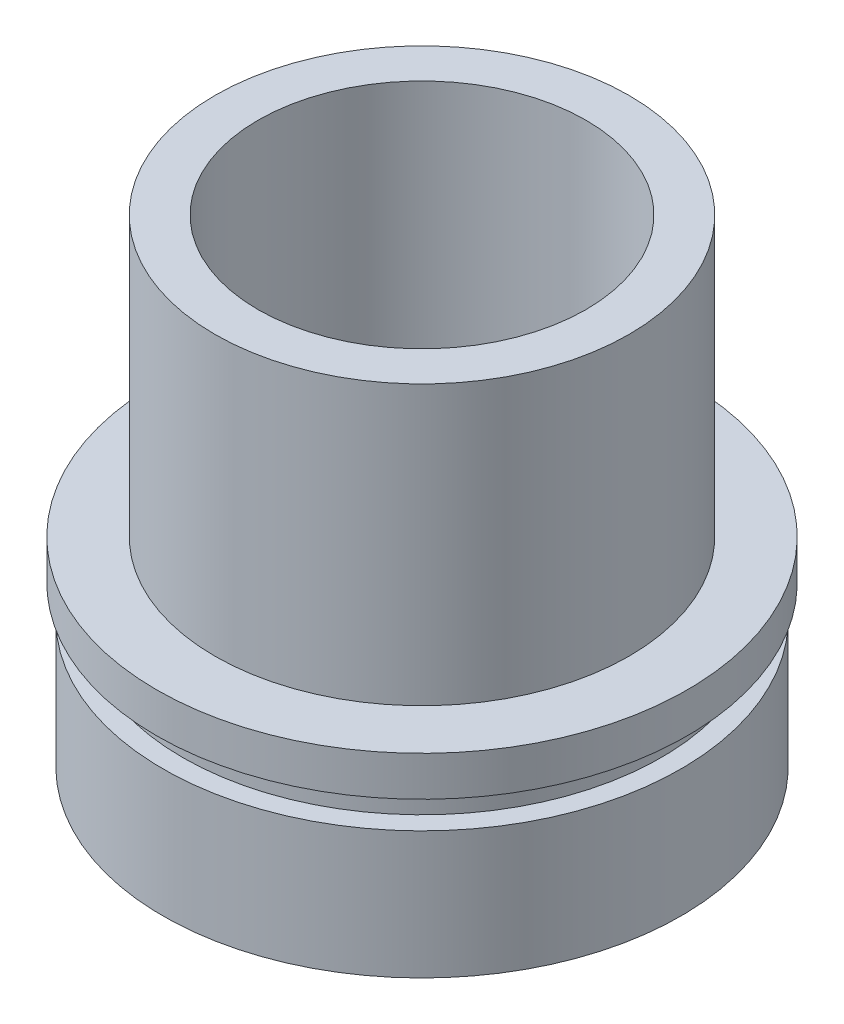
SolidWorks part; units mm, degrees
ref_plane "Front Plane" through (0, 0, 0) normal (0, 0, 1) x (1, 0, 0)
ref_plane "Top Plane" through (0, 0, 0) normal (0, 1, 0) x (1, 0, 0)
ref_plane "Right Plane" through (0, 0, 0) normal (1, 0, 0) x (0, 0, -1)
sketch "Sketch1" plane through (0, 0, 0) normal (0, 0, 1) x (1, 0, 0)
  line L0 (0, 0) -> (0, 61.1946) construction
  line L1 (-6.5405, 0) -> (-10.3251, 0)
  line L2 (-10.3251, 0) -> (-10.3251, 6.35)
  line L3 (-10.3251, 6.35) -> (-10.5791, 6.35)
  line L4 (-10.5791, 6.35) -> (-10.5791, 7.9375)
  line L5 (-10.5791, 7.9375) -> (-8.255, 7.9375)
  line L6 (-6.5405, 0) -> (-6.5405, 19.05)
  line L8 (-6.5405, 19.05) -> (-8.255, 19.05)
  line L12 (-8.255, 19.05) -> (-8.255, 7.9375)
  dimension "D1" = 20.6502
  dimension "D2" = 13.081
  dimension "D3" = 6.35
  dimension "D4" = 19.05
  dimension "D5" = 0.254
  dimension "D6" = 16.51
  dimension "D7" = 1.5875
revolve "Revolve1" add sketch "Sketch1" angle 360 about L0
sketch "Sketch3" plane through (0, 0, 0) normal (0, 0, 1) x (1, 0, 0)
  line L0 (0, 0) -> (0, -6.2728) construction
  line L1 (-6.5405, 7.9375) -> (-6.5405, 19.05)
  line L2 (-6.5405, 19.05) -> (-6.5405, 0) construction
  line L3 (10.5791, 7.9375) -> (-10.5791, 7.9375) construction
  line L4 (-6.5405, 19.05) -> (-4.9022, 19.05)
  line L5 (8.255, 19.05) -> (-8.255, 19.05) construction
  line L6 (-4.9022, 19.05) -> (-4.9022, 6.2992)
  line L7 (-4.9022, 6.2992) -> (-6.5405, 7.9375)
  dimension "D1" = 45
  dimension "D2" = 9.8044
revolve "Cut-Revolve2" [suppressed] cut sketch "Sketch3" angle 360 about L0
sketch "Sketch4" plane through (0, 0, 0) normal (0, 0, 1) x (1, 0, 0)
  line L0 (-10.3251, 6.35) -> (10.3251, 6.35) construction
  line L1 (-11.4466, 6.35) -> (-9.5402, 6.35)
  line L2 (-11.4466, 6.35) -> (-11.4466, 5.08)
  line L3 (-11.4466, 5.08) -> (-9.5402, 5.08)
  line L4 (-9.5402, 6.35) -> (-9.5402, 5.08)
  line L5 (-10.5791, 6.35) -> (10.5791, 6.35) construction
  line L6 (0, 0) -> (0, -3.7143) construction
  dimension "D1" = 1.27
  dimension "D2" = 19.0805
revolve "Cut-Revolve3" cut sketch "Sketch4" angle 360 about L6
